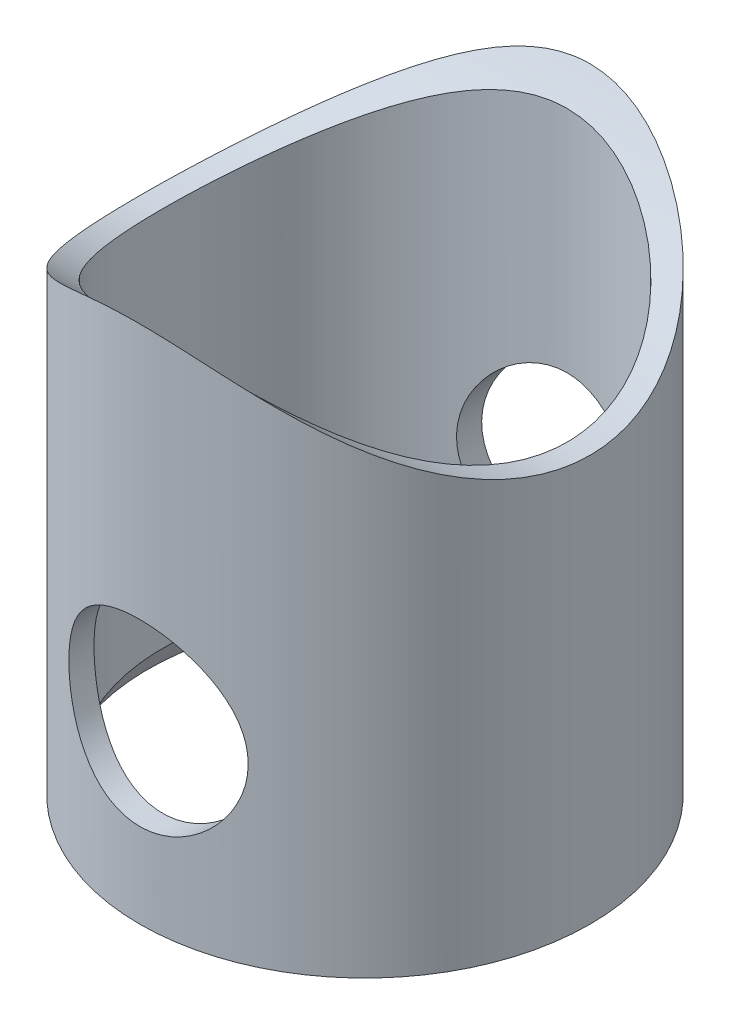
SolidWorks part; units mm, degrees
ref_plane "Ebene vorne" through (0, 0, 0) normal (0, 0, 1) x (1, 0, 0)
ref_plane "Ebene oben" through (0, 0, 0) normal (0, 1, 0) x (1, 0, 0)
ref_plane "Ebene rechts" through (0, 0, 0) normal (1, 0, 0) x (0, 0, -1)
ref_plane "Ebene1" through (0, 134.5, 0) normal (0, 1, 0) x (-1, 0, 0)
sketch "Skizze1" plane through (0, 134.5, 0) normal (0, 1, 0) x (1, 0, 0)
  circle A0 centre (0, 0) radius 11.95
  circle A1 centre (0, 0) radius 13.3
extrude "Aufsatz-Linear austragen1" add sketch "Skizze1" along normal blind 40
sketch "Skizze2" plane through (0, 0, 0) normal (1, 0, 0) x (0, 0, -1)
  line L0 (-15.3039, 167.5) -> (-25.0069, 167.5)
  line L1 (-35.0069, 177.5) -> (-35.0069, 197.5)
  line L2 (-25.0069, 207.5) -> (24.9931, 207.5)
  line L3 (34.9931, 197.5) -> (34.9931, 177.5)
  line L4 (-35.0069, 175) -> (34.9931, 175) construction
  line L5 (15.2902, 167.5) -> (24.9931, 167.5)
  line L6 (-0.0069, 175) -> (-0.0069, 134.5) construction
  circle A0 centre (-0.0069, 175) radius 16.5 construction
  arc A1 (-14.4298, 166.9857) -> (14.4161, 166.9857) centre (-0.0069, 175) ccw
  arc A2 (-25.0069, 167.5) -> (-35.0069, 177.5) centre (-25.0069, 177.5) cw
  arc A3 (24.9931, 167.5) -> (34.9931, 177.5) centre (24.9931, 177.5) ccw
  arc A4 (24.9931, 207.5) -> (34.9931, 197.5) centre (24.9931, 197.5) cw
  arc A5 (-35.0069, 197.5) -> (-25.0069, 207.5) centre (-25.0069, 197.5) cw
  arc A6 (-15.3039, 167.5) -> (-14.4298, 166.9857) centre (-15.3039, 166.5) cw
  arc A7 (14.4161, 166.9857) -> (15.2902, 167.5) centre (15.2902, 166.5) cw
  dimension "D1" = 10
  dimension "D2" = 10
  dimension "D3" = 1
  dimension "D4" = 1
extrude "Schnitt-Linear austragen2" cut sketch "Skizze2" against normal through all and the other way through all
chamfer "Fase1" distance 1.5 angle 30 1 edges at (0, 134.5, 11.95)
sketch "Skizze3" plane through (0, 0, 0) normal (0, 0, 1) x (1, 0, 0)
  circle A0 centre (0, 144.8) radius 5.3
extrude "Schnitt-Linear austragen3" cut sketch "Skizze3" against normal through all and the other way through all
